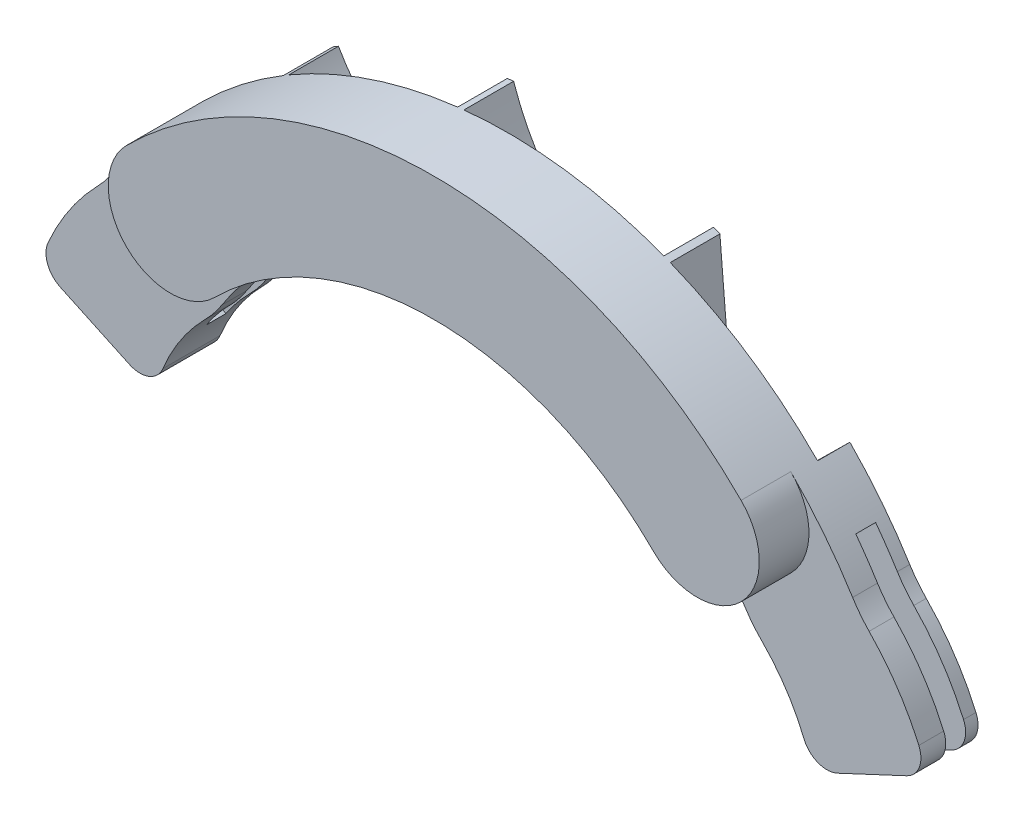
SolidWorks part; units mm, degrees
ref_plane "前视基准面" through (0, 0, 0) normal (0, 0, 1) x (1, 0, 0)
ref_plane "上视基准面" through (0, 0, 0) normal (0, 1, 0) x (1, 0, 0)
ref_plane "右视基准面" through (0, 0, 0) normal (1, 0, 0) x (0, 0, -1)
sketch "草图1" plane through (0, 0, 0) normal (0, 0, 1) x (1, 0, 0)
  line L0 (0, 0) -> (0, 30) construction
  arc A0 (21.2132, 21.2132) -> (-21.2132, 21.2132) centre (0, 0) ccw construction
  arc A1 (24.7487, 24.7487) -> (-24.7487, 24.7487) centre (0, 0) ccw
  arc A2 (17.6777, 17.6777) -> (-17.6777, 17.6777) centre (0, 0) ccw
  arc A3 (17.6777, 17.6777) -> (24.7487, 24.7487) centre (21.2132, 21.2132) ccw
  arc A4 (-24.7487, 24.7487) -> (-17.6777, 17.6777) centre (-21.2132, 21.2132) ccw
  point P4 (0, 30)
  dimension "D2" = 25
  dimension "D3" = 5
  dimension "D1" = 90
extrude "凸台-拉伸1" add sketch "草图1" along normal blind 4
sketch "草图2" plane through (0, 0, 0) normal (0, 0, -1) x (-1, 0, 0)
  line L0 (0, 30) -> (0, 0) construction
  line L1 (-34.0772, 8.2021) -> (-28.5098, 5.6004)
  line L3 (34.0772, 8.2021) -> (28.5098, 5.6004)
  arc A0 (25.9808, 15) -> (-25.9808, 15) centre (0, 0) ccw construction
  arc A1 (29.7314, 18.4674) -> (-29.7314, 18.4674) centre (0, 0) ccw
  arc A2 (21.6506, 12.5) -> (-21.6506, 12.5) centre (0, 0) ccw
  arc A5 (-31.0586, 16.7704) -> (-35.0629, 10.8154) centre (-16.6708, 2.7722) ccw
  arc A6 (-35.0629, 10.8154) -> (-34.0772, 8.2021) centre (-33.2304, 10.014) ccw
  arc A7 (-25.8116, 6.6559) -> (-21.6506, 12.5) centre (-11.2992, 0.7265) cw
  arc A8 (-28.5098, 5.6004) -> (-25.8116, 6.6559) centre (-27.663, 7.4123) ccw
  arc A9 (28.5098, 5.6004) -> (25.8116, 6.6559) centre (27.663, 7.4123) cw
  arc A10 (25.8116, 6.6559) -> (21.6506, 12.5) centre (11.2992, 0.7265) ccw
  arc A11 (35.0629, 10.8154) -> (34.0772, 8.2021) centre (33.2304, 10.014) cw
  arc A12 (31.0586, 16.7704) -> (35.0629, 10.8154) centre (16.6708, 2.7722) cw
  arc A13 (29.7314, 18.4674) -> (31.0586, 16.7704) centre (38.2261, 23.7438) ccw
  arc A14 (-29.7314, 18.4674) -> (-31.0586, 16.7704) centre (-38.2261, 23.7438) cw
  point P4 (0, 30)
  point P33 (30.3109, 17.5)
  point P36 (-30.3109, 17.5)
  dimension "D2" = 25
  dimension "D3" = 2
  dimension "D6" = 35
  dimension "D5" = 10
  dimension "D1" = 120
  dimension "D4" = 150
extrude "凸台-拉伸2" add sketch "草图2" along normal blind 2
sketch "草图7" plane through (0, 0, -2) normal (0, 0, -1) x (-1, 0, 0)
  line L0 (-13.4912, 21.0473) -> (-12.5236, 32.6827)
  line L1 (-14.022, 20.6974) -> (-13.0423, 32.4792)
  line L2 (-14.2085, 18.4548) -> (-12.7372, 36.1479) construction
  line L3 (-13.7102, 18.4134) -> (-12.2389, 36.1065) construction
  line L6 (28.5098, 5.6004) -> (34.0772, 8.2021)
  line L7 (28.5098, 5.6004) -> (34.0772, 8.2021)
  line L8 (-34.0772, 8.2021) -> (-28.5098, 5.6004)
  line L9 (-34.0772, 8.2021) -> (-28.5098, 5.6004)
  arc A0 (21.6506, 12.5) -> (-21.6506, 12.5) centre (0, 0) ccw construction
  arc A1 (18.1047, 29.9536) -> (9.6984, 23.0421) centre (5.0242, 37.2953) cw
  arc A2 (29.7314, 18.4674) -> (-29.7314, 18.4674) centre (0, 0) ccw
  arc A3 (21.6506, 12.5) -> (-21.6506, 12.5) centre (0, 0) ccw
  arc A4 (29.7314, 18.4674) -> (-29.7314, 18.4674) centre (0, 0) ccw
  arc A5 (21.6506, 12.5) -> (-21.6506, 12.5) centre (0, 0) ccw
  arc A6 (17.6748, 30.2093) -> (8.9594, 23.3395) centre (5.0242, 37.2953) cw
  arc A7 (17.8264, 30.4869) -> (8.6646, 23.2597) centre (5.0242, 37.2953) cw construction
  arc A8 (21.6506, 12.5) -> (-21.6506, 12.5) centre (0, 0) ccw construction
  arc A9 (29.7314, 18.4674) -> (-29.7314, 18.4674) centre (0, 0) ccw construction
  arc A10 (4.077, 34.7617) -> (-3.2383, 24.7894) centre (-14.9169, 41.0255) cw
  arc A11 (18.2679, 30.2522) -> (8.7901, 22.7757) centre (5.0242, 37.2953) cw construction
  arc A12 (3.5686, 34.8176) -> (-4.3889, 24.6117) centre (-14.9169, 41.0255) cw
  arc A13 (3.6021, 34.9183) -> (-3.5303, 25.1953) centre (-14.9169, 41.0255) cw construction
  arc A25 (25.8116, 6.6559) -> (21.6506, 12.5) centre (11.2992, 0.7265) ccw
  arc A26 (25.8116, 6.6559) -> (21.6506, 12.5) centre (11.2992, 0.7265) ccw
  arc A27 (25.8116, 6.6559) -> (28.5098, 5.6004) centre (27.663, 7.4123) ccw
  arc A28 (25.8116, 6.6559) -> (28.5098, 5.6004) centre (27.663, 7.4123) ccw
  arc A29 (34.0772, 8.2021) -> (35.0629, 10.8154) centre (33.2304, 10.014) ccw
  arc A30 (34.0772, 8.2021) -> (35.0629, 10.8154) centre (33.2304, 10.014) ccw
  arc A31 (35.0629, 10.8154) -> (31.0586, 16.7704) centre (16.6708, 2.7722) ccw
  arc A32 (35.0629, 10.8154) -> (31.0586, 16.7704) centre (16.6708, 2.7722) ccw
  arc A33 (29.7314, 18.4674) -> (31.0586, 16.7704) centre (38.2261, 23.7438) ccw
  arc A34 (29.7314, 18.4674) -> (31.0586, 16.7704) centre (38.2261, 23.7438) ccw
  arc A35 (-31.0586, 16.7704) -> (-29.7314, 18.4674) centre (-38.2261, 23.7438) ccw
  arc A36 (-31.0586, 16.7704) -> (-29.7314, 18.4674) centre (-38.2261, 23.7438) ccw
  arc A37 (-31.0586, 16.7704) -> (-35.0629, 10.8154) centre (-16.6708, 2.7722) ccw
  arc A38 (-31.0586, 16.7704) -> (-35.0629, 10.8154) centre (-16.6708, 2.7722) ccw
  arc A39 (-35.0629, 10.8154) -> (-34.0772, 8.2021) centre (-33.2304, 10.014) ccw
  arc A40 (-35.0629, 10.8154) -> (-34.0772, 8.2021) centre (-33.2304, 10.014) ccw
  arc A41 (-28.5098, 5.6004) -> (-25.8116, 6.6559) centre (-27.663, 7.4123) ccw
  arc A42 (-28.5098, 5.6004) -> (-25.8116, 6.6559) centre (-27.663, 7.4123) ccw
  arc A43 (-21.6506, 12.5) -> (-25.8116, 6.6559) centre (-11.2992, 0.7265) ccw
  arc A44 (-21.6506, 12.5) -> (-25.8116, 6.6559) centre (-11.2992, 0.7265) ccw
  dimension "D3" = 15
  dimension "D4" = 20
  dimension "D2" = 0.5
  dimension "D1" = 0
  dimension "D5" = 0.5
  dimension "D6" = 0.5
extrude "凸台-拉伸3" add sketch "草图7" along normal blind 4 contours L1 L0 M15 M11 | A12 A5 A10 M11 | A6 A5 A1 M11
fillet "圆角1" radius 1 3 edges at (-9.6984, 23.0421, -4) (3.2383, 24.7894, -4) (13.4912, 21.0473, -4)
fillet "圆角2" radius 10 2 edges at (21.6506, 12.5, -1) (-21.6506, 12.5, -1)
sketch "草图8" plane through (0, 0, -2) normal (0, 0, -1) x (-1, 0, 0)
  line L0 (0, 0) -> (0, 40.365) construction
  line L1 (0, 0) -> (43.3707, 23.0606) construction
  line L2 (24.3383, 9.4299) -> (33.2106, 14.1474)
  line L4 (28.5098, 5.6004) -> (34.0772, 8.2021)
  line L5 (28.5098, 5.6004) -> (34.0772, 8.2021)
  line L6 (1.4554, -2.7371) -> (44.8261, 20.3235) construction
  arc A0 (31.2217, 16.6009) -> (31.0586, 16.7704) centre (16.6708, 2.7722) ccw
  arc A10 (21.067, 13.4604) -> (9.3569, 23.1829) centre (0, 0) ccw
  arc A11 (21.067, 13.4604) -> (22.4078, 11.7884) centre (29.4938, 18.8446) ccw
  arc A12 (25.8116, 6.6559) -> (22.4078, 11.7884) centre (11.2992, 0.7265) ccw
  arc A13 (25.8116, 6.6559) -> (28.5098, 5.6004) centre (27.663, 7.4123) ccw
  arc A14 (34.0772, 8.2021) -> (35.0629, 10.8154) centre (33.2304, 10.014) ccw
  arc A15 (35.0629, 10.8154) -> (31.0586, 16.7704) centre (16.6708, 2.7722) ccw
  arc A16 (29.7314, 18.4674) -> (31.0586, 16.7704) centre (38.2261, 23.7438) ccw
  arc A17 (29.7314, 18.4674) -> (18.1047, 29.9536) centre (0, 0) ccw
  arc A18 (10.0674, 23.1685) -> (18.1047, 29.9536) centre (5.0242, 37.2953) ccw
  arc A19 (9.3569, 23.1829) -> (10.0674, 23.1685) centre (9.7312, 24.1103) ccw
  arc A21 (22.3264, 11.8712) -> (22.4078, 11.7884) centre (29.4938, 18.8446) ccw
  arc A22 (25.8116, 6.6559) -> (24.3383, 9.4299) centre (11.2992, 0.7265) ccw
  arc A23 (25.8116, 6.6559) -> (28.5098, 5.6004) centre (27.663, 7.4123) ccw
  arc A24 (34.0772, 8.2021) -> (35.0629, 10.8154) centre (33.2304, 10.014) ccw
  arc A25 (35.0629, 10.8154) -> (33.2106, 14.1474) centre (16.6708, 2.7722) ccw
  dimension "D1" = 62
  dimension "D2" = 3.1
  dimension "D3" = 0
extrude "凸台-拉伸4" add sketch "草图8" along normal blind 1.6 contours L2 M5 M6 M7 M8 M9
sketch "草图9" plane through (0, 0, -3.6) normal (0, 0, -1) x (-1, 0, 0)
  line L0 (29.7314, 18.4674) -> (21.067, 13.4604)
  line L1 (24.3383, 9.4299) -> (33.2106, 14.1474)
  line L2 (33.2106, 14.1474) -> (24.3383, 9.4299)
  line L3 (28.5098, 5.6004) -> (34.0772, 8.2021)
  line L5 (28.5098, 5.6004) -> (34.0772, 8.2021)
  arc A4 (25.8116, 6.6559) -> (24.3383, 9.4299) centre (11.2992, 0.7265) ccw
  arc A5 (25.8116, 6.6559) -> (28.5098, 5.6004) centre (27.663, 7.4123) ccw
  arc A6 (34.0772, 8.2021) -> (35.0629, 10.8154) centre (33.2304, 10.014) ccw
  arc A7 (35.0629, 10.8154) -> (33.2106, 14.1474) centre (16.6708, 2.7722) ccw
  arc A8 (25.8116, 6.6559) -> (24.3383, 9.4299) centre (11.2992, 0.7265) ccw
  arc A9 (25.8116, 6.6559) -> (28.5098, 5.6004) centre (27.663, 7.4123) ccw
  arc A10 (34.0772, 8.2021) -> (35.0629, 10.8154) centre (33.2304, 10.014) ccw
  arc A11 (35.0629, 10.8154) -> (33.2106, 14.1474) centre (16.6708, 2.7722) ccw
  arc A16 (33.2106, 14.1474) -> (31.0586, 16.7704) centre (16.6708, 2.7722) ccw
  arc A17 (29.7314, 18.4674) -> (31.0586, 16.7704) centre (38.2261, 23.7438) ccw
  arc A18 (29.7314, 18.4674) -> (18.1047, 29.9536) centre (0, 0) ccw
  arc A19 (10.0674, 23.1685) -> (18.1047, 29.9536) centre (5.0242, 37.2953) ccw
  arc A20 (9.3569, 23.1829) -> (10.0674, 23.1685) centre (9.7312, 24.1103) ccw
  arc A21 (21.067, 13.4604) -> (9.3569, 23.1829) centre (0, 0) ccw
  arc A22 (21.067, 13.4604) -> (22.4078, 11.7884) centre (29.4938, 18.8446) ccw
  arc A23 (24.3383, 9.4299) -> (22.4078, 11.7884) centre (11.2992, 0.7265) ccw
  arc A24 (33.2106, 14.1474) -> (31.0586, 16.7704) centre (16.6708, 2.7722) ccw
  arc A25 (29.7314, 18.4674) -> (31.0586, 16.7704) centre (38.2261, 23.7438) ccw
  arc A30 (21.067, 13.4604) -> (22.4078, 11.7884) centre (29.4938, 18.8446) ccw
  arc A31 (24.3383, 9.4299) -> (22.4078, 11.7884) centre (11.2992, 0.7265) ccw
  dimension "D1" = 0
  dimension "D2" = 0
extrude "凸台-拉伸5" add sketch "草图9" along normal blind 1
sketch "草图10" plane through (0, 0, -2) normal (0, 0, -1) x (-1, 0, 0)
  line L0 (0, 0) -> (0, 41.1783) construction
  line L1 (0, 0) -> (-43.356, 27.0918) construction
  line L4 (-17.7933, 17.5613) -> (-24.9106, 24.5858)
  line L6 (-19.4582, 15.6964) -> (-27.9827, 21.0231)
  line L8 (-14.022, 20.6974) -> (-13.0423, 32.4792)
  line L9 (-34.0772, 8.2021) -> (-28.5098, 5.6004)
  arc A8 (-22.4078, 11.7884) -> (-25.8116, 6.6559) centre (-11.2992, 0.7265) ccw
  arc A9 (-22.4078, 11.7884) -> (-21.067, 13.4604) centre (-29.4938, 18.8446) ccw
  arc A10 (-14.022, 20.6974) -> (-21.067, 13.4604) centre (0, 0) ccw
  arc A11 (-13.0423, 32.4792) -> (-29.7314, 18.4674) centre (0, 0) ccw
  arc A12 (-31.0586, 16.7704) -> (-29.7314, 18.4674) centre (-38.2261, 23.7438) ccw
  arc A13 (-31.0586, 16.7704) -> (-35.0629, 10.8154) centre (-16.6708, 2.7722) ccw
  arc A14 (-35.0629, 10.8154) -> (-34.0772, 8.2021) centre (-33.2304, 10.014) ccw
  arc A15 (-28.5098, 5.6004) -> (-25.8116, 6.6559) centre (-27.663, 7.4123) ccw
  arc A27 (-17.7933, 17.5613) -> (-19.4582, 15.6964) centre (0, 0) ccw
  arc A28 (-24.9106, 24.5858) -> (-27.9827, 21.0231) centre (0, 0) ccw
  point P3 (1.8779, 3.5318)
  point P5 (-43.2623, 27.5333)
  point P6 (1.5898, 2.5441)
  point P7 (-41.7662, 29.636)
  dimension "D1" = 58
  dimension "D2" = 2.5
  dimension "D3" = 0
extrude "凸台-拉伸6" add sketch "草图10" along normal blind 1.6
sketch "草图12" plane through (0, 0, -3.6) normal (0, 0, -1) x (-1, 0, 0)
  line L2 (-27.9827, 21.0231) -> (-19.4582, 15.6964)
  line L3 (-17.7933, 17.5613) -> (-24.9106, 24.5858)
  line L5 (-17.7933, 17.5613) -> (-24.9106, 24.5858)
  line L6 (-19.4582, 15.6964) -> (-27.9827, 21.0231)
  line L7 (-34.0772, 8.2021) -> (-28.5098, 5.6004)
  line L9 (-34.0772, 8.2021) -> (-28.5098, 5.6004)
  arc A2 (-24.9106, 24.5858) -> (-27.9827, 21.0231) centre (0, 0) ccw
  arc A3 (-17.7933, 17.5613) -> (-19.4582, 15.6964) centre (0, 0) ccw
  arc A4 (-24.9106, 24.5858) -> (-27.9827, 21.0231) centre (0, 0) ccw
  arc A5 (-17.7933, 17.5613) -> (-19.4582, 15.6964) centre (0, 0) ccw
  arc A12 (-19.4582, 15.6964) -> (-21.067, 13.4604) centre (0, 0) ccw
  arc A13 (-27.9827, 21.0231) -> (-29.7314, 18.4674) centre (0, 0) ccw
  arc A14 (-31.0586, 16.7704) -> (-29.7314, 18.4674) centre (-38.2261, 23.7438) ccw
  arc A15 (-31.0586, 16.7704) -> (-35.0629, 10.8154) centre (-16.6708, 2.7722) ccw
  arc A16 (-35.0629, 10.8154) -> (-34.0772, 8.2021) centre (-33.2304, 10.014) ccw
  arc A17 (-28.5098, 5.6004) -> (-25.8116, 6.6559) centre (-27.663, 7.4123) ccw
  arc A18 (-22.4078, 11.7884) -> (-25.8116, 6.6559) centre (-11.2992, 0.7265) ccw
  arc A19 (-22.4078, 11.7884) -> (-21.067, 13.4604) centre (-29.4938, 18.8446) ccw
  arc A20 (-19.4582, 15.6964) -> (-21.067, 13.4604) centre (0, 0) ccw
  arc A21 (-27.9827, 21.0231) -> (-29.7314, 18.4674) centre (0, 0) ccw
  arc A22 (-31.0586, 16.7704) -> (-29.7314, 18.4674) centre (-38.2261, 23.7438) ccw
  arc A23 (-31.0586, 16.7704) -> (-35.0629, 10.8154) centre (-16.6708, 2.7722) ccw
  arc A24 (-35.0629, 10.8154) -> (-34.0772, 8.2021) centre (-33.2304, 10.014) ccw
  arc A25 (-28.5098, 5.6004) -> (-25.8116, 6.6559) centre (-27.663, 7.4123) ccw
  arc A26 (-22.4078, 11.7884) -> (-25.8116, 6.6559) centre (-11.2992, 0.7265) ccw
  arc A27 (-22.4078, 11.7884) -> (-21.067, 13.4604) centre (-29.4938, 18.8446) ccw
  dimension "D1" = 0
  dimension "D2" = 0
extrude "凸台-拉伸8" add sketch "草图12" along normal blind 1
